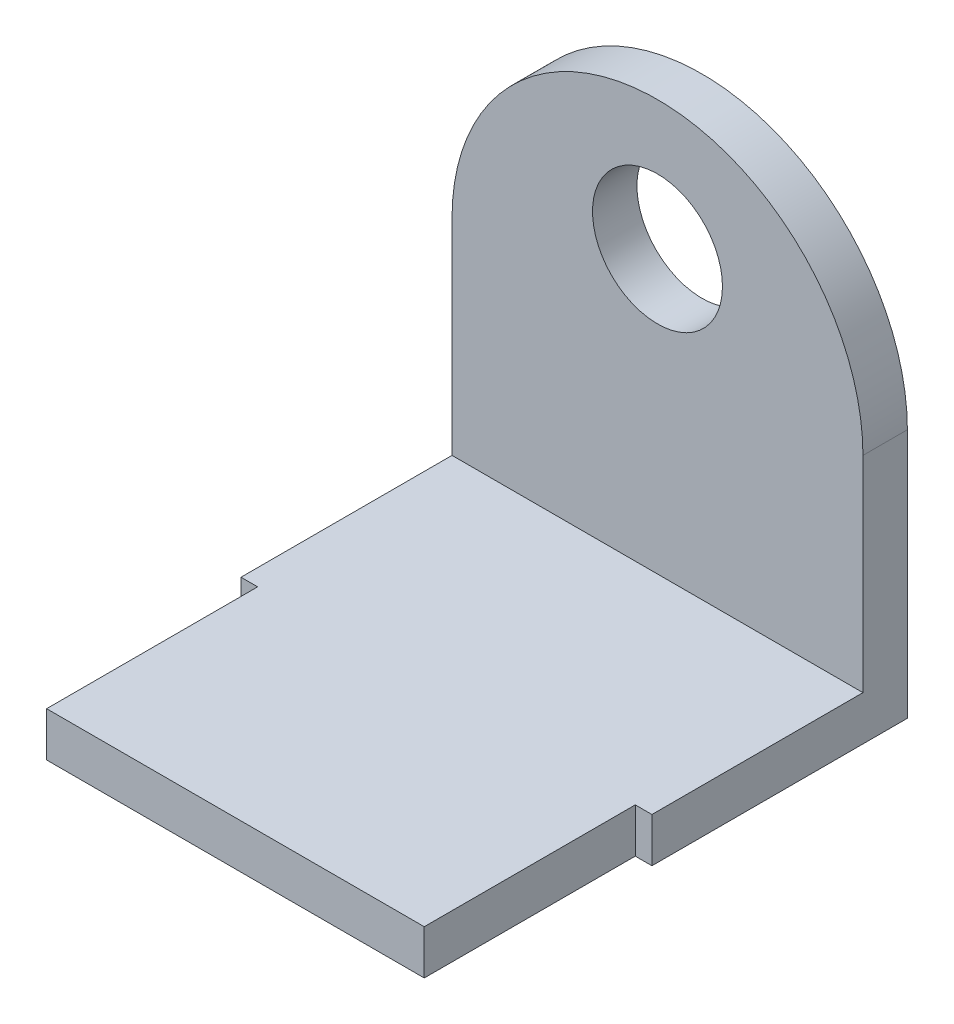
SolidWorks part; units mm, degrees
ref_plane "Front Plane" through (0, 0, 0) normal (0, 0, 1) x (1, 0, 0)
ref_plane "Top Plane" through (0, 0, 0) normal (0, 1, 0) x (1, 0, 0)
ref_plane "Right Plane" through (0, 0, 0) normal (1, 0, 0) x (0, 0, -1)
sketch "Sketch1" plane through (0, 0, 0) normal (0, 0, 1) x (1, 0, 0)
  line L0 (-27.6104, -18.5) -> (-27.6104, -22.5) construction
  line L1 (-27.6104, 18.5) -> (-27.6104, 12.7) construction
  line L3 (-46.1104, -22.5) -> (-9.1104, -22.5)
  line L5 (-55.2208, 32.3799) -> (0, -22.5) construction
  line L6 (-55.2208, -22.5) -> (0, 32.3799) construction
  line L7 (-9.1104, 0) -> (0, 0) construction
  line L8 (-46.1104, 0) -> (-55.2208, 0) construction
  line L9 (-27.6104, 18.5) -> (-27.6104, 32.3799) construction
  line L10 (-27.6104, -18.5) -> (-27.6104, 1) construction
  line L11 (-46.1104, 0) -> (-46.1104, -22.5)
  line L12 (-9.1104, 0) -> (-9.1104, -22.5)
  arc A0 (-9.1104, 0) -> (-46.1104, 0) centre (-27.6104, 0) ccw
  circle A1 centre (-27.6104, 6.85) radius 5.85
  point P2 (-27.6104, 4.94)
  dimension "D1" = 37
  dimension "D2" = 11.7
  dimension "D3" = 5.8
  dimension "D4" = 4
extrude "Boss-Extrude1" add sketch "Sketch1" along normal blind 4
sketch "Sketch2" plane through (0, 0, 0) normal (0, 0, 1) x (1, 0, 0)
  line L0 (-9.1104, -22.5) -> (-9.1104, 0) construction
  line L1 (-46.1104, -22.5) -> (-9.1104, -22.5)
  line L2 (-46.1104, -22.5) -> (-46.1104, -18.5)
  line L3 (-46.1104, -18.5) -> (-9.1104, -18.5)
  line L4 (-9.1104, -22.5) -> (-9.1104, -18.5)
  dimension "D1" = 4
extrude "Boss-Extrude2" add sketch "Sketch2" along normal blind 42
sketch "Sketch3" plane through (0, -18.5, 0) normal (0, 1, 0) x (1, 0, 0)
  line L0 (-44.6104, -23) -> (-44.6104, -42)
  line L1 (-46.1104, -42) -> (-46.1104, -4) construction
  line L2 (-46.1104, -23) -> (-46.1104, -42)
  line L3 (-9.1104, -42) -> (-46.1104, -42) construction
  line L4 (-44.6104, -42) -> (-46.1104, -42)
  line L6 (-10.6104, -23) -> (-10.6104, -42)
  line L7 (-9.1104, -42) -> (-9.1104, -4) construction
  line L8 (-9.1104, -23) -> (-9.1104, -42)
  line L9 (-44.6104, -23) -> (-46.1104, -23)
  line L10 (-10.6104, -42) -> (-9.1104, -42)
  line L11 (-46.1104, -23) -> (-46.1104, -42)
  line L14 (-10.6104, -23) -> (-9.1104, -23)
extrude "Cut-Extrude1" cut sketch "Sketch3" against normal blind 10 contours L14 L6 M5 M6 | L0 L9 M4 M5
